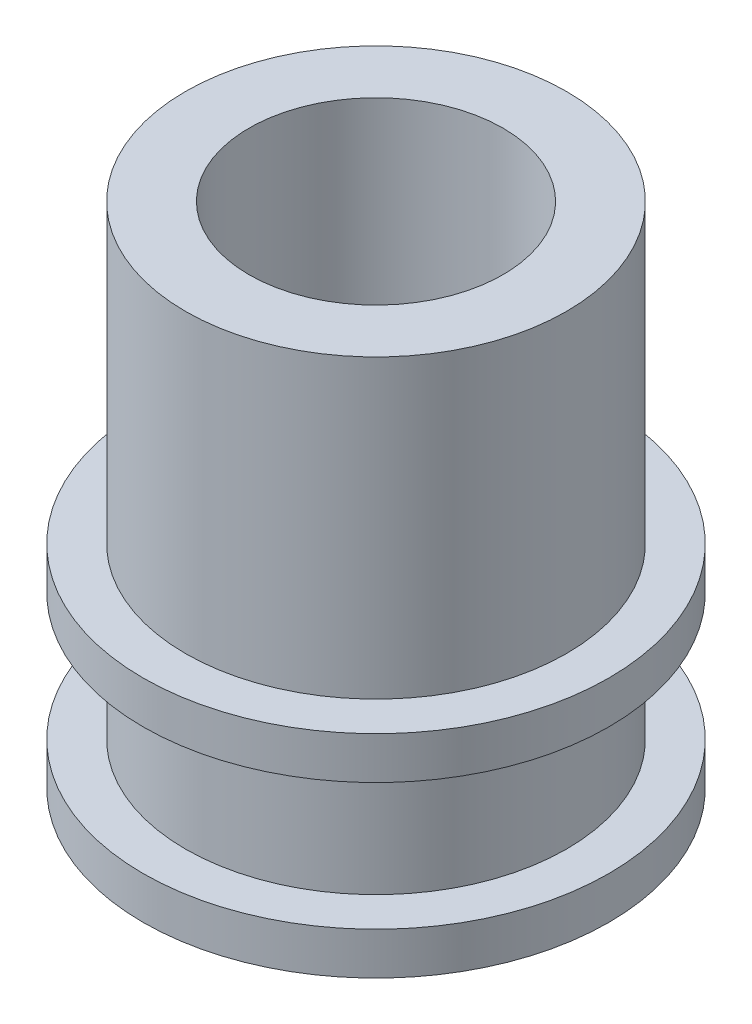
SolidWorks part; units mm, degrees
ref_plane "Plan1" through (0, 0, 0) normal (0, 0, 1) x (1, 0, 0)
ref_plane "Plan2" through (0, 0, 0) normal (0, 1, 0) x (1, 0, 0)
ref_plane "Plan3" through (0, 0, 0) normal (1, 0, 0) x (0, 0, -1)
sketch "Esquisse1" plane through (0, 0, 0) normal (0, 0, 1) x (1, 0, 0)
  line L0 (0, 0) -> (0, 20) construction
  line L1 (-3, 12) -> (-3, 0)
  line L2 (-4.5, 12) -> (-4.5, 5)
  line L3 (-3, 0) -> (-5.5, 0)
  line L4 (-5.5, 0) -> (-5.5, 1)
  line L5 (-5.5, 1) -> (-4.5, 1)
  line L7 (-4.5, 4) -> (-5.5, 4)
  line L8 (-5.5, 4) -> (-5.5, 5)
  line L9 (-5.5, 5) -> (-4.5, 5)
  line L10 (-4.5, 12) -> (-3, 12)
  line L11 (-4.5, 4) -> (-4.5, 1)
  dimension "D1" = 6
  dimension "D2" = 9
  dimension "D3" = 12
  dimension "D4" = 1
  dimension "D5" = 1
  dimension "D6" = 3
  dimension "D7" = 11
revolve "Base-Révolution" add sketch "Esquisse1" angle 360 about L0
